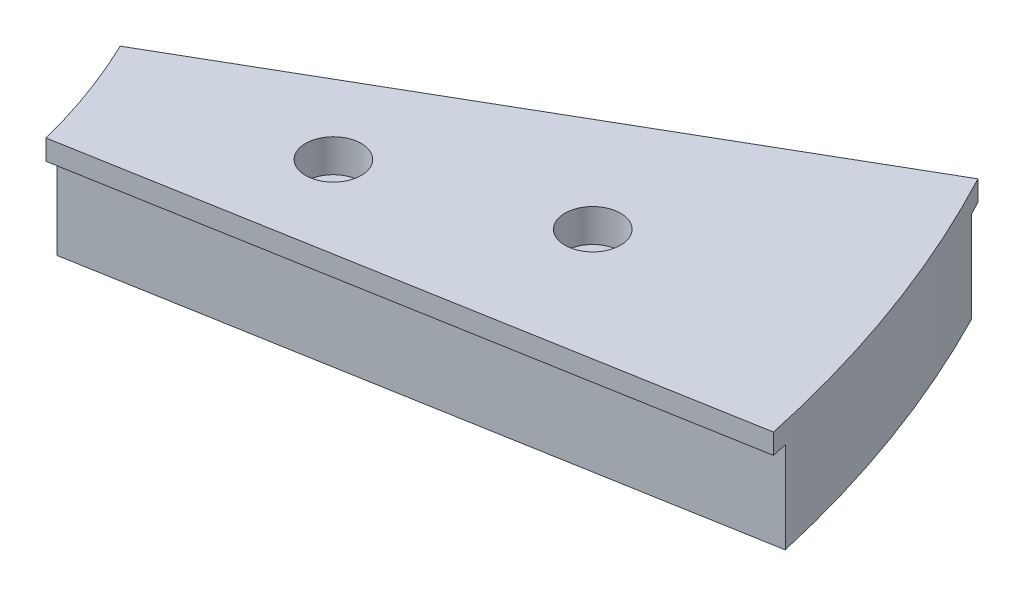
SolidWorks part; units mm, degrees
ref_plane "FRONT" through (0, 0, 0) normal (0, 0, 1) x (1, 0, 0)
ref_plane "TOP" through (0, 0, 0) normal (0, 1, 0) x (1, 0, 0)
ref_plane "RIGHT" through (0, 0, 0) normal (1, 0, 0) x (0, 0, -1)
sketch "Sketch1" plane through (0, 0, 0) normal (0, 1, 0) x (1, 0, 0)
  line L0 (0, 0) -> (192.296, 33.907) construction
  line L1 (0, 0) -> (169.1023, 97.6313) construction
  line L2 (0, 0) -> (195.2625, 0) construction
  line L3 (87.2071, 42.1002) -> (172.561, 91.3792)
  line L4 (93.866, 23.8051) -> (190.9268, 40.9195)
  arc A2 (93.866, 23.8051) -> (87.2071, 42.1002) centre (0, 0) ccw
  arc A3 (190.9268, 40.9195) -> (172.561, 91.3792) centre (0, 0) ccw
  dimension "D1" = 96.8375
  dimension "D2" = 195.2625
  dimension "D3" = 10
  dimension "D4" = 30
  dimension "D5" = 7.1437
  dimension "D6" = 7.1437
extrude "Base-Extrude" add sketch "Sketch1" along normal blind 17.4625
sketch "Sketch2" plane through (0, 0, 0) normal (0, 1, 0) x (1, 0, 0)
  line L0 (76.2, 32.9442) -> (200.025, 104.4346)
  line L1 (76.2, 23.1532) -> (200.025, 44.9869)
  line L2 (200.025, 44.9869) -> (200.025, 104.4346)
  line L3 (76.2, 23.1532) -> (76.2, 0)
  line L4 (76.2, 0) -> (228.6, 0)
  line L5 (228.6, 0) -> (228.6, 127)
  line L6 (228.6, 127) -> (76.2, 127)
  line L7 (76.2, 127) -> (76.2, 32.9442)
  line L9 (0, 0) -> (169.1023, 97.6313) construction
  line L10 (0, 0) -> (192.296, 33.907) construction
  line L11 (0, 0) -> (195.2625, 0) construction
  line L12 (-50, 0) -> (50, 0) construction
  line L13 (0, -50) -> (0, 50) construction
  dimension "D1" = 127
  dimension "D2" = 76.2
  dimension "D3" = 200.025
  dimension "D4" = 228.6
  dimension "D5" = 9.5694
  dimension "D6" = 9.5694
extrude "Cut-Extrude2" cut sketch "Sketch2" along normal blind 14.2875
sketch "HOLE LOC SKETCH" plane through (0, 0, 0) normal (0, 1, 0) x (1, 0, 0)
  line L0 (90.9975, 33.1204) -> (183.4867, 66.7837) construction
  line L1 (172.561, 91.3792) -> (87.2071, 42.1002) construction
  line L2 (93.866, 23.8051) -> (190.9268, 40.9195) construction
  circle A0 centre (0, 0) radius 111.125 construction
  circle A1 centre (0, 0) radius 174.625 construction
  circle A2 centre (0, 0) radius 158.75 construction
  circle A3 centre (0, 0) radius 127 construction
  arc A4 (93.866, 23.8051) -> (87.2071, 42.1002) centre (0, 0) ccw construction
  arc A5 (190.9268, 40.9195) -> (172.561, 91.3792) centre (0, 0) ccw construction
  dimension "D1" = 222.25
  dimension "D2" = 254
  dimension "D3" = 317.5
  dimension "D4" = 349.25
sketch "Sketch4" plane through (184.0226, 17.4625, -50.4248) normal (0, 1, 0) x (-1, 0, 0)
  line L0 (93.0251, 17.3045) -> (0.5359, -16.3589) construction
  circle A0 centre (184.0226, 50.4248) radius 158.75 construction
  point P0 (34.8464, -3.8709)
sketch "Sketch5" plane through (149.1762, 17.4625, -54.2957) normal (1, 0, 0) x (0, 0, 1)
  line L0 (0, 0) -> (0, 203.2)
  line L1 (0, 203.2) -> (2.8067, 203.2)
  line L2 (2.8067, 203.2) -> (2.8067, 5.1594)
  line L3 (2.8067, 5.1594) -> (4.3656, 5.1594)
  line L4 (4.3656, 5.1594) -> (4.3656, 0)
  line L5 (4.3656, 0) -> (0, 0)
  line L6 (0, 110) -> (0, -10) construction
  dimension "Diameter" = 5.6134
  dimension "Depth" = 203.2
  dimension "C-Bore Diameter" = 8.7312
  dimension "C-Bore Depth" = 5.1594
hole_wizard "CBORE10-OV1" positions "Sketch4" profile "Sketch5" legacy
sketch "Sketch6" plane through (132.637, 17.4625, -45.5075) normal (0, 1, 0) x (-1, 0, 0)
  line L0 (41.6395, 12.3872) -> (-50.8497, -21.2762) construction
  circle A0 centre (132.637, 45.5075) radius 127 construction
  point P0 (13.296, 2.071)
sketch "Sketch7" plane through (119.341, 17.4625, -43.4366) normal (1, 0, 0) x (0, 0, 1)
  line L0 (0, 0) -> (0, 203.2)
  line L1 (0, 203.2) -> (2.8067, 203.2)
  line L2 (2.8067, 203.2) -> (2.8067, 5.1594)
  line L3 (2.8067, 5.1594) -> (4.3656, 5.1594)
  line L4 (4.3656, 5.1594) -> (4.3656, 0)
  line L5 (4.3656, 0) -> (0, 0)
  line L6 (0, 110) -> (0, -10) construction
  dimension "Diameter" = 5.6134
  dimension "Depth" = 203.2
  dimension "C-Bore Diameter" = 8.7312
  dimension "C-Bore Depth" = 5.1594
hole_wizard "CBORE10-OV2" positions "Sketch6" profile "Sketch7" legacy
sketch "Sketch8" plane through (106.9291, 0, -17.9444) normal (0, -1, 0) x (1, 0, 0)
  line L0 (-15.9316, -15.1759) -> (76.5576, -48.8393) construction
  circle A0 centre (-106.9291, 17.9444) radius 111.125 construction
  point P0 (-2.5058, -20.0625)
sketch "Sketch9" plane through (104.4233, 0, -38.007) normal (1, 0, 0) x (0, 0, -1)
  line L0 (0, 0) -> (0, 15.5991)
  line L1 (0, 15.5991) -> (2.1828, 14.2875)
  line L2 (2.1828, 14.2875) -> (2.1828, 7.1437)
  line L3 (2.1828, 7.1437) -> (2.394, 7.1437)
  line L4 (2.394, 0) -> (0, 0)
  line L5 (0, -11.3109) -> (0, 121.1557) construction
  line L6 (0, 15.5991) -> (-2.1828, 14.2875) construction
  line L7 (2.394, 7.1437) -> (2.394, 0)
  dimension "Depth" = 14.2875
  dimension "Drill Angle" = 118
  dimension "Diameter" = 4.3656
  dimension "C-Bore Diameter" = 4.7879
  dimension "C-Bore Depth" = 7.1437
hole_wizard "Hole3" positions "Sketch8" profile "Sketch9" legacy
sketch "Sketch10" plane through (132.5937, 0, -22.849) normal (0, -1, 0) x (1, 0, 0)
  line L0 (-28.1704, -12.764) -> (-28.1704, -17.5519)
  line L10 (-25.7764, -15.158) -> (-30.5643, -15.158)
  line L11 (-26.0971, -16.355) -> (-30.2436, -13.961)
  line L12 (-25.8128, -15.5737) -> (-30.5279, -14.7423)
  line L13 (-25.9208, -15.9768) -> (-30.4199, -14.3392)
  line L14 (-26.9734, -17.2312) -> (-29.3673, -13.0848)
  line L15 (-26.6316, -16.9919) -> (-29.7092, -13.3241)
  line L16 (-27.3516, -17.4076) -> (-28.9891, -12.9084)
  line L17 (-26.3365, -16.6968) -> (-30.0042, -13.6192)
  line L18 (-27.7547, -17.5156) -> (-28.5861, -12.8004)
  circle A0 centre (-28.1704, -15.158) radius 2.3939
  dimension "D12" = 10
  dimension "D18" = 4.7879
  dimension "D1" = 10
  dimension "D10" = 10
  dimension "D11" = 10
  dimension "D13" = 10
  dimension "D14" = 10
  dimension "D15" = 10
  dimension "D16" = 10
  dimension "D17" = 10
other "SF_.18751"
sketch "Sketch11" plane through (158.5086, 0, -36.7286) normal (0, -1, 0) x (1, 0, 0)
  line L0 (-67.5111, 3.6083) -> (24.9781, -30.0551) construction
  circle A0 centre (-158.5086, 36.7286) radius 174.625 construction
  point P0 (5.5852, -22.9966)
sketch "Sketch12" plane through (164.0938, 0, -59.7253) normal (1, 0, 0) x (0, 0, -1)
  line L0 (0, 0) -> (0, 15.5991)
  line L1 (0, 15.5991) -> (2.1828, 14.2875)
  line L2 (2.1828, 14.2875) -> (2.1828, 7.1437)
  line L3 (2.1828, 7.1437) -> (2.394, 7.1437)
  line L4 (2.394, 0) -> (0, 0)
  line L5 (0, -11.3109) -> (0, 121.1557) construction
  line L6 (0, 15.5991) -> (-2.1828, 14.2875) construction
  line L7 (2.394, 7.1437) -> (2.394, 0)
  dimension "Depth" = 14.2875
  dimension "Drill Angle" = 118
  dimension "Diameter" = 4.3656
  dimension "C-Bore Diameter" = 4.7879
  dimension "C-Bore Depth" = 7.1437
hole_wizard "Hole4" positions "Sketch11" profile "Sketch12" legacy
sketch "Sketch13" plane through (192.2642, 0, -44.5673) normal (0, -1, 0) x (1, 0, 0)
  line L0 (-28.1704, -12.764) -> (-28.1704, -17.5519)
  line L10 (-25.7764, -15.158) -> (-30.5643, -15.158)
  line L11 (-26.0971, -16.355) -> (-30.2436, -13.961)
  line L12 (-25.8128, -15.5737) -> (-30.5279, -14.7423)
  line L13 (-25.9208, -15.9768) -> (-30.4199, -14.3392)
  line L14 (-26.9734, -17.2312) -> (-29.3673, -13.0848)
  line L15 (-26.6316, -16.9919) -> (-29.7092, -13.3241)
  line L16 (-27.3516, -17.4076) -> (-28.9891, -12.9084)
  line L17 (-26.3365, -16.6968) -> (-30.0042, -13.6192)
  line L18 (-27.7547, -17.5156) -> (-28.5861, -12.8004)
  circle A0 centre (-28.1704, -15.158) radius 2.3939
  dimension "D12" = 10
  dimension "D18" = 4.7879
  dimension "D1" = 10
  dimension "D10" = 10
  dimension "D11" = 10
  dimension "D13" = 10
  dimension "D14" = 10
  dimension "D15" = 10
  dimension "D16" = 10
  dimension "D17" = 10
other "SF_.18752"
